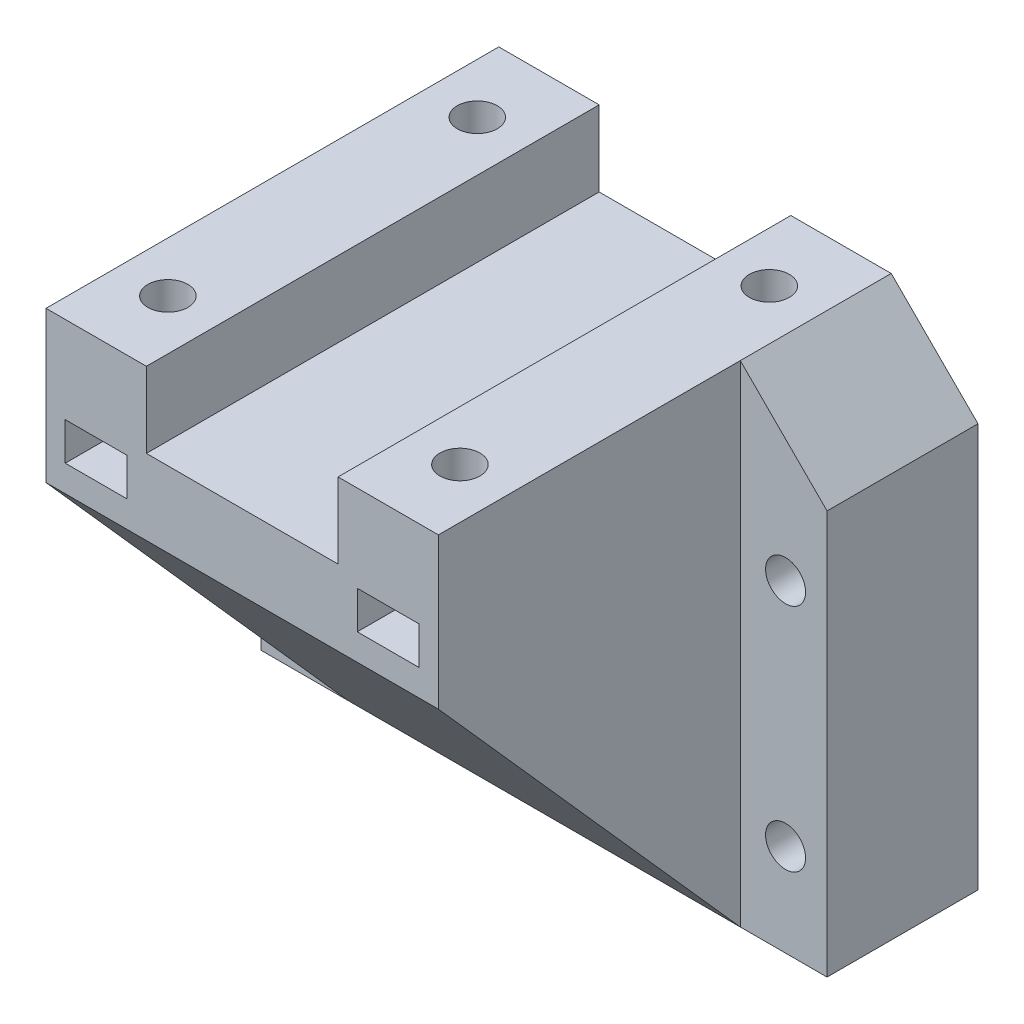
SolidWorks part; units mm, degrees
ref_plane "Спереди" through (0, 0, 0) normal (0, 0, 1) x (1, 0, 0)
ref_plane "Сверху" through (0, 0, 0) normal (0, 1, 0) x (1, 0, 0)
ref_plane "Справа" through (0, 0, 0) normal (1, 0, 0) x (0, 0, -1)
other "Configuration Table"
sketch "Эскиз1" plane through (0, 0, 0) normal (0, 0, 1) x (1, 0, 0)
  line L0 (-26.5, 27.5) -> (-26.5, -27.5) construction
  line L1 (37.5, -27.5) -> (-37.5, -27.5)
  line L2 (37.5, -27.5) -> (37.5, 27.5)
  line L3 (37.5, 27.5) -> (-37.5, 27.5)
  line L4 (-37.5, -27.5) -> (-37.5, 27.5)
  line L5 (37.5, -27.5) -> (-37.5, 27.5) construction
  line L6 (37.5, 27.5) -> (-37.5, -27.5) construction
  line L7 (26.5, 27.5) -> (26.5, -27.5) construction
  line L8 (-32, 27.5) -> (-32, -27.5) construction
  line L9 (32, 27.5) -> (32, -27.5) construction
  line L10 (-32, 0) -> (-37.5, 0) construction
  line L11 (32, 0) -> (37.5, 0) construction
  line L12 (-32, 15.25) -> (32, 15.25) construction
  line L13 (-32, -15.25) -> (32, -15.25) construction
  circle A0 centre (-32, 15.25) radius 2.65
  circle A1 centre (32, 15.25) radius 2.65
  circle A2 centre (32, -15.25) radius 2.65
  circle A3 centre (-32, -15.25) radius 2.65
  point P0 (0, 0)
  dimension "D9" = 5.3
  dimension "D1" = 55
  dimension "D2" = 75
  dimension "D3" = 11
  dimension "D4" = 11
  dimension "D5" = 64
  dimension "D6" = 12.25
  dimension "D7" = 12.25
  dimension "D8" = 30.5
extrude "Бобышка-Вытянуть1" add sketch "Эскиз1" along normal blind 20
sketch "Эскиз2" plane through (0, 0, 20) normal (0, 0, 1) x (1, 0, 0)
  line L0 (-37.5, -27.5) -> (37.5, -27.5) construction
  line L1 (26, 27.5) -> (-26, 27.5)
  line L2 (26, 27.5) -> (26, -27.5)
  line L3 (26, -27.5) -> (-26, -27.5)
  line L4 (-26, 27.5) -> (-26, -27.5)
  line L5 (26, 27.5) -> (-26, -27.5) construction
  line L6 (26, -27.5) -> (-26, 27.5) construction
  point P0 (0, 0)
  dimension "D1" = 52
extrude "Бобышка-Вытянуть2" add sketch "Эскиз2" along normal blind 40
sketch "Эскиз3" plane through (-26, 0, 0) normal (-1, 0, 0) x (0, 0, 1)
  line L0 (60, 17.5) -> (20, -27.5)
  line L1 (60, 27.5) -> (60, -27.5) construction
  line L2 (60, -27.5) -> (20, -27.5) construction
  line L3 (20, -27.5) -> (60, -27.5)
  line L4 (60, -27.5) -> (60, 17.5)
  line L5 (60, 17.5) -> (60, 27.5) construction
  point P6 (20, -27.5)
  dimension "D1" = 10
extrude "Вырез-Вытянуть1" cut sketch "Эскиз3" against normal through all
sketch "Эскиз4" plane through (0, 27.5, 0) normal (0, 1, 0) x (1, 0, 0)
  line L0 (-12.7, -60) -> (-12.7, 0)
  line L1 (12.7, -60) -> (12.7, 0)
  line L2 (-37.5, 0) -> (-12.7, 0)
  line L3 (12.7, 0) -> (37.5, 0)
  line L4 (-12.7, -60) -> (-26, -60)
  line L5 (12.7, -60) -> (26, -60)
  line L8 (37.5, 0) -> (-37.5, 0)
  line L10 (-37.5, 0) -> (-37.5, -20)
  line L12 (-26, -60) -> (26, -60)
  line L14 (-37.5, 0) -> (-37.5, -20)
  line L26 (-37.5, -20) -> (-26, -20)
  line L27 (-37.5, -20) -> (-26, -20)
  line L32 (-26, -20) -> (-26, -60)
  line L33 (-26, -20) -> (-26, -60)
  line L34 (26, -60) -> (26, -20)
  line L35 (26, -60) -> (26, -20)
  line L36 (26, -20) -> (37.5, -20)
  line L37 (26, -20) -> (37.5, -20)
  line L38 (37.5, -20) -> (37.5, 0)
  line L39 (37.5, -20) -> (37.5, 0)
  dimension "D2" = 25.4
  dimension "D1" = 0
extrude "Бобышка-Вытянуть3" add sketch "Эскиз4" along normal blind 10
sketch "Эскиз5" plane through (0, 37.5, 0) normal (0, 1, 0) x (1, 0, 0)
  line L0 (19.35, -60) -> (19.35, 0) construction
  line L1 (12.7, -60) -> (26, -60) construction
  line L2 (37.5, 0) -> (12.7, 0) construction
  line L3 (0, -60) -> (0, 0) construction
  line L4 (12.7, -60) -> (-12.7, -60) construction
  line L5 (-19.35, -60) -> (-19.35, 0) construction
  circle A0 centre (19.35, -50.5) radius 2.65
  circle A1 centre (19.35, -9.5) radius 2.65
  circle A2 centre (-19.35, -9.5) radius 2.65
  circle A3 centre (-19.35, -50.5) radius 2.65
  dimension "D3" = 5.3
  dimension "D1" = 9.5
  dimension "D2" = 9.5
extrude "Вырез-Вытянуть2" cut sketch "Эскиз5" against normal blind 22
sketch "Эскиз6" plane through (0, 0, 0) normal (0, 0, -1) x (-1, 0, 0)
  line L0 (-19.35, 15.5) -> (-19.35, 37.5) construction
  line L1 (-16.7, 15.5) -> (-22, 15.5) construction
  line L2 (-37.5, 37.5) -> (-12.7, 37.5) construction
  line L3 (0, 27.5) -> (0, -27.5) construction
  line L4 (-15.25, 26) -> (-23.45, 26)
  line L5 (-15.25, 26) -> (-15.25, 21)
  line L6 (-15.25, 21) -> (-23.45, 21)
  line L7 (-23.45, 26) -> (-23.45, 21)
  line L8 (-15.25, 26) -> (-23.45, 21) construction
  line L9 (-15.25, 21) -> (-23.45, 26) construction
  line L10 (-12.7, 27.5) -> (12.7, 27.5) construction
  line L11 (37.5, -27.5) -> (-37.5, -27.5) construction
  line L12 (15.25, 21) -> (23.45, 26) construction
  line L13 (15.25, 26) -> (23.45, 21) construction
  line L14 (19.35, 15.5) -> (19.35, 37.5) construction
  line L15 (23.45, 26) -> (23.45, 21)
  line L16 (15.25, 21) -> (23.45, 21)
  line L17 (15.25, 26) -> (15.25, 21)
  line L18 (15.25, 26) -> (23.45, 26)
  point P6 (-19.35, 23.5)
  point P23 (19.35, 23.5)
  dimension "D1" = 5
  dimension "D2" = 8.2
  dimension "D3" = 14
extrude "Вырез-Вытянуть3" cut sketch "Эскиз6" against normal blind 13
sketch "Эскиз8" plane through (0, 0, 60) normal (0, 0, 1) x (1, 0, 0)
  line L0 (15.25, 26) -> (23.45, 26) construction
  line L1 (23.45, 26) -> (23.45, 21) construction
  line L2 (23.45, 21) -> (15.25, 21) construction
  line L3 (15.25, 21) -> (15.25, 26) construction
  line L4 (-23.45, 21) -> (-23.45, 26) construction
  line L5 (-23.45, 26) -> (-15.25, 26) construction
  line L6 (-15.25, 21) -> (-23.45, 21) construction
  line L7 (-15.25, 26) -> (-15.25, 21) construction
  line L8 (15.25, 26) -> (23.45, 26)
  line L9 (23.45, 26) -> (23.45, 21)
  line L10 (23.45, 21) -> (15.25, 21)
  line L11 (15.25, 21) -> (15.25, 26)
  line L12 (-23.45, 21) -> (-23.45, 26)
  line L13 (-23.45, 26) -> (-15.25, 26)
  line L14 (-15.25, 21) -> (-23.45, 21)
  line L15 (-15.25, 26) -> (-15.25, 21)
extrude "Вырез-Вытянуть4" cut sketch "Эскиз8" against normal blind 13
sketch "Эскиз10" plane through (0, 21, 0) normal (0, 1, 0) x (1, 0, 0)
  line L0 (23.45, -13) -> (23.45, 0) construction
  line L1 (23.45, -7.1329) -> (19.35, -4.7657)
  line L2 (19.35, -4.7657) -> (15.25, -7.1329)
  line L3 (15.25, -7.1329) -> (15.25, -11.8671)
  line L4 (15.25, -11.8671) -> (19.35, -14.2343)
  line L5 (19.35, -14.2343) -> (23.45, -11.8671)
  line L6 (23.45, -11.8671) -> (23.45, -7.1329)
  line L7 (15.25, -47) -> (15.25, -60) construction
  line L8 (23.45, -48.1329) -> (19.35, -45.7657)
  line L9 (19.35, -45.7657) -> (15.25, -48.1329)
  line L10 (15.25, -48.1329) -> (15.25, -52.8671)
  line L11 (15.25, -52.8671) -> (19.35, -55.2343)
  line L12 (19.35, -55.2343) -> (23.45, -52.8671)
  line L13 (23.45, -52.8671) -> (23.45, -48.1329)
  line L14 (0, -60) -> (0, 0) construction
  line L15 (12.7, -60) -> (-12.7, -60) construction
  line L16 (-23.45, -52.8671) -> (-23.45, -48.1329)
  line L17 (-19.35, -55.2343) -> (-23.45, -52.8671)
  line L18 (-15.25, -52.8671) -> (-19.35, -55.2343)
  line L19 (-15.25, -48.1329) -> (-15.25, -52.8671)
  line L20 (-19.35, -45.7657) -> (-15.25, -48.1329)
  line L21 (-23.45, -48.1329) -> (-19.35, -45.7657)
  line L22 (-23.45, -11.8671) -> (-23.45, -7.1329)
  line L23 (-19.35, -14.2343) -> (-23.45, -11.8671)
  line L24 (-15.25, -11.8671) -> (-19.35, -14.2343)
  line L25 (-15.25, -7.1329) -> (-15.25, -11.8671)
  line L26 (-19.35, -4.7657) -> (-15.25, -7.1329)
  line L27 (-23.45, -7.1329) -> (-19.35, -4.7657)
  circle A0 centre (19.35, -9.5) radius 4.1 construction
  circle A1 centre (19.35, -50.5) radius 4.1 construction
  circle A2 centre (-19.35, -50.5) radius 4.1 construction
  circle A3 centre (-19.35, -9.5) radius 4.1 construction
extrude "Вырез-Вытянуть5" cut sketch "Эскиз10" along normal blind 4.2
chamfer "Фаска1" distance 11.5 angle 45 2 edges at (37.5, 37.5, 10) (-37.5, 37.5, 10)
